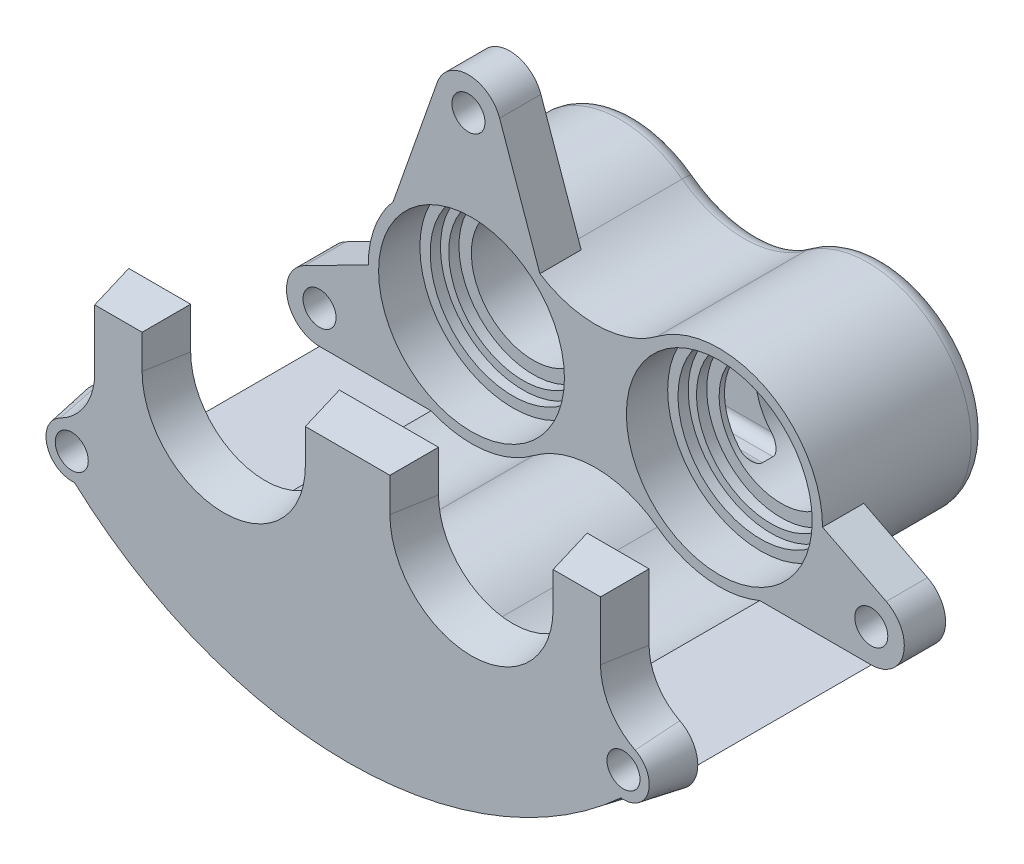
SolidWorks part; units mm, degrees
ref_plane "Front Plane" through (0, 0, 0) normal (0, 0, 1) x (1, 0, 0)
ref_plane "Top Plane" through (0, 0, 0) normal (0, 1, 0) x (1, 0, 0)
ref_plane "Right Plane" through (0, 0, 0) normal (1, 0, 0) x (0, 0, -1)
sketch "Sketch1" plane through (0, 0, 0) normal (0, 0, 1) x (1, 0, 0)
  line L0 (0, 0) -> (-39.7017, 0) construction
  line L1 (0, 0) -> (0, 20.5469) construction
  arc A0 (-9.525, 12.7) -> (-9.525, -12.7) centre (-19.05, 0) ccw
  arc A1 (9.525, 12.7) -> (9.525, -12.7) centre (19.05, 0) cw
  arc A2 (-9.525, -12.7) -> (9.525, -12.7) centre (0, -25.4) cw
  arc A3 (-9.525, 12.7) -> (9.525, 12.7) centre (0, 25.4) ccw
  dimension "D1" = 15.875
  dimension "D2" = 38.1
extrude "Boss-Extrude1" add sketch "Sketch1" along normal mid plane 25.4
ref_plane "Plane1" through (19.05, 0, 0) normal (1, 0, 0) x (0, 0, -1)
sketch "Sketch2" plane through (19.05, 0, 0) normal (1, 0, 0) x (0, 0, -1)
  line L0 (0, 0) -> (-18.4539, 0) construction
  line L1 (0, 0) -> (0, 18.5951) construction
  line L2 (-12.7, 0) -> (-12.7, 14.2875)
  line L3 (-12.7, 15.875) -> (-12.7, -15.875) construction
  line L4 (-12.7, 14.2875) -> (-6.35, 14.2875)
  line L5 (-6.35, 14.2875) -> (-6.35, 12.7)
  line L6 (-6.35, 12.7) -> (-4.7752, 12.7)
  line L7 (-4.7752, 12.7) -> (-4.7752, 11.43)
  line L8 (-4.7752, 11.43) -> (-3.2004, 11.43)
  line L9 (-3.2004, 11.43) -> (-3.2004, 9.525)
  line L10 (-3.2004, 9.525) -> (9.4996, 9.525)
  line L11 (9.4996, 9.525) -> (9.4996, 4.445)
  line L12 (9.4996, 4.445) -> (8.128, 4.445)
  line L13 (8.128, 4.445) -> (8.128, 0)
  line L14 (8.128, 0) -> (-12.7, 0)
other "AlignGroup7" parameters "D1"=3.473, "D2"=1.2173, "D3"=1.1997, "D4"=15.5959, "D5"=4.4106, "D6"=1.6937, "D7"=3.473, "D8"=13.1111, "D9"=1.3755, "D10"=1.4858, "D11"=0, "D12"=0
revolve "Cut-Revolve1" cut sketch "Sketch2" angle 360 about L0
mirror "Mirror1" about plane through (0, 0, 0) normal (1, 0, 0) of "Cut-Revolve1"
sketch "Sketch3" plane through (0, 0, 0) normal (1, 0, 0) x (0, 0, -1)
  line L0 (-7.16, 0) -> (6.2106, 0) construction
  line L1 (-0.7937, 7.9375) -> (0.7937, 7.9375)
  line L2 (-2.3812, 6.35) -> (-2.3812, -6.35)
  line L3 (-0.7937, -7.9375) -> (0.7938, -7.9375)
  line L4 (2.3812, 6.35) -> (2.3812, -6.35)
  line L5 (0, 9.1986) -> (0, -10.7325) construction
  arc A0 (0.7938, -7.9375) -> (2.3812, -6.35) centre (0.7937, -6.35) ccw
  arc A1 (-2.3812, -6.35) -> (-0.7937, -7.9375) centre (-0.7937, -6.35) ccw
  arc A2 (0.7937, 7.9375) -> (2.3812, 6.35) centre (0.7937, 6.35) cw
  arc A3 (-0.7937, 7.9375) -> (-2.3812, 6.35) centre (-0.7937, 6.35) ccw
  dimension "D1" = 1.5875
  dimension "D2" = 12.7
  dimension "D3" = 1.5875
extrude "Cut-Extrude1" cut sketch "Sketch3" against normal up to surface and the other way up to surface
sketch "Sketch5" plane through (0, 0, 12.7) normal (0, 0, 1) x (1, 0, 0)
  line L0 (-25.2717, -14.605) -> (-42.418, -14.605)
  line L1 (-44.7243, -4.9987) -> (-34.925, -0.0057)
  arc A0 (-25.2717, -14.605) -> (-34.925, -0.0057) centre (-19.05, 0) cw
  arc A1 (-9.525, 12.7) -> (-9.525, -12.7) centre (-19.05, 0) ccw construction
  arc A2 (-42.418, -14.605) -> (-44.7243, -4.9987) centre (-42.418, -9.525) cw
  dimension "D2" = 5.08
  dimension "D1" = 27
  dimension "D3" = 23.368
  dimension "D4" = 9.525
extrude "Boss-Extrude2" add sketch "Sketch5" against normal blind 6.35
mirror "Mirror2" about plane through (0, 0, 0) normal (1, 0, 0) of "Boss-Extrude2"
sketch "Sketch6" plane through (0, 0, 12.7) normal (0, 0, 1) x (1, 0, 0)
  line L0 (-19.05, 0) -> (-19.05, 42.7891) construction
  line L1 (-31.0974, 10.3381) -> (-24.3147, 29.6253)
  line L2 (-14.7301, 29.6253) -> (-8.476, 11.8408)
  arc A0 (-31.0974, 10.3381) -> (-8.476, 11.8408) centre (-19.05, 0) cw
  arc A1 (-9.525, 12.7) -> (-34.925, -0.0057) centre (-19.05, 0) ccw construction
  arc A2 (-24.3147, 29.6253) -> (-14.7301, 29.6253) centre (-19.5224, 27.94) cw
  circle A3 centre (-19.5224, 27.94) radius 2.54
  dimension "D3" = 5.08
  dimension "D4" = 5.08
  dimension "D1" = 38.75
  dimension "D2" = 27.94
  dimension "D5" = 0.4724
  dimension "D6" = 19.375
extrude "Boss-Extrude4" add sketch "Sketch6" against normal blind 6.35
sketch "Sketch8" plane through (0, 0, 6.35) normal (0, 0, -1) x (-1, 0, 0)
  line L0 (-42.418, -14.605) -> (-25.2717, -14.605) construction
  line L1 (-42.418, -14.605) -> (-25.2717, -14.605)
  line L2 (42.418, -14.605) -> (25.2717, -14.605) construction
  line L3 (42.418, -14.605) -> (25.2717, -14.605)
  arc A0 (9.525, -12.7) -> (-9.525, -12.7) centre (0, -25.4) ccw construction
  arc A1 (9.525, -12.7) -> (-9.525, -12.7) centre (0, -25.4) ccw
  arc A2 (-9.525, 12.7) -> (-9.525, -12.7) centre (-19.05, 0) ccw construction
  arc A3 (-25.2717, -14.605) -> (-9.525, -12.7) centre (-19.05, 0) ccw
  arc A4 (9.525, -12.7) -> (9.525, 12.7) centre (19.05, 0) ccw construction
  arc A5 (9.525, -12.7) -> (25.2717, -14.605) centre (19.05, 0) ccw
  arc A6 (-42.418, -14.605) -> (42.418, -14.605) centre (0, 32.6492) ccw
  dimension "D1" = 63.5
extrude "Boss-Extrude5" add sketch "Sketch8" against normal blind 38.1
sketch "Sketch9" plane through (0, 0, 44.45) normal (0, 0, 1) x (1, 0, 0)
  line L0 (-40.005, 2.7025) -> (-40.005, 12.8625)
  line L1 (-40.005, 12.8625) -> (-30.48, 12.8625)
  line L2 (-30.48, 12.8625) -> (-30.48, 6.5125)
  line L3 (-7.62, 6.5125) -> (-7.62, 12.8625)
  line L4 (-7.62, 12.8625) -> (7.62, 12.8625)
  line L5 (7.62, 12.8625) -> (7.62, 6.5125)
  line L6 (30.48, 6.5125) -> (30.48, 12.8625)
  line L7 (30.48, 12.8625) -> (40.005, 12.8625)
  line L8 (40.005, 12.8625) -> (40.005, 2.7025)
  line L9 (0, 0) -> (0, 15.7201) construction
  arc A0 (-42.418, -14.605) -> (42.418, -14.605) centre (0, 32.6492) ccw construction
  arc A1 (-42.418, -14.605) -> (42.418, -14.605) centre (0, 32.6492) ccw
  arc A2 (-44.7243, -4.9987) -> (-42.418, -14.605) centre (-42.418, -9.525) ccw construction
  arc A3 (-44.7243, -4.9987) -> (-42.418, -14.605) centre (-42.418, -9.525) ccw
  arc A4 (42.418, -14.605) -> (44.7243, -4.9987) centre (42.418, -9.525) ccw construction
  arc A5 (42.418, -14.605) -> (44.7243, -4.9987) centre (42.418, -9.525) ccw
  arc A6 (-44.7243, -4.9987) -> (-40.005, 2.7025) centre (-48.6482, 2.7025) ccw
  arc A7 (-30.48, 6.5125) -> (-7.62, 6.5125) centre (-19.05, 6.5125) ccw
  arc A8 (7.62, 6.5125) -> (30.48, 6.5125) centre (19.05, 6.5125) ccw
  arc A9 (40.005, 2.7025) -> (44.7243, -4.9987) centre (48.6482, 2.7025) ccw
  dimension "D1" = 11.43
  dimension "D2" = 9.525
  dimension "D3" = 10.16
  dimension "D4" = 15.24
  dimension "D5" = 6.35
extrude "Boss-Extrude6" add sketch "Sketch9" along normal blind 6.35 draft 10
other "Hole1"
sketch "Sketch10" plane through (0, 0, 50.8) normal (0, 0, 1) x (1, 0, 0)
  circle A0 centre (42.418, -9.525) radius 2.54
  arc A1 (42.0101, -13.4643) -> (44.2159, -5.9963) centre (42.418, -9.525) ccw construction
  dimension "D1" = 5.08
mirror "Mirror3" about plane through (0, 0, 0) normal (1, 0, 0) of "Hole1"
fillet "Fillet1" radius 2.54 4 edges at (0, -9.525, -12.7) (-34.925, 0, -12.7) (0, 9.525, -12.7) (34.925, 0, -12.7)
